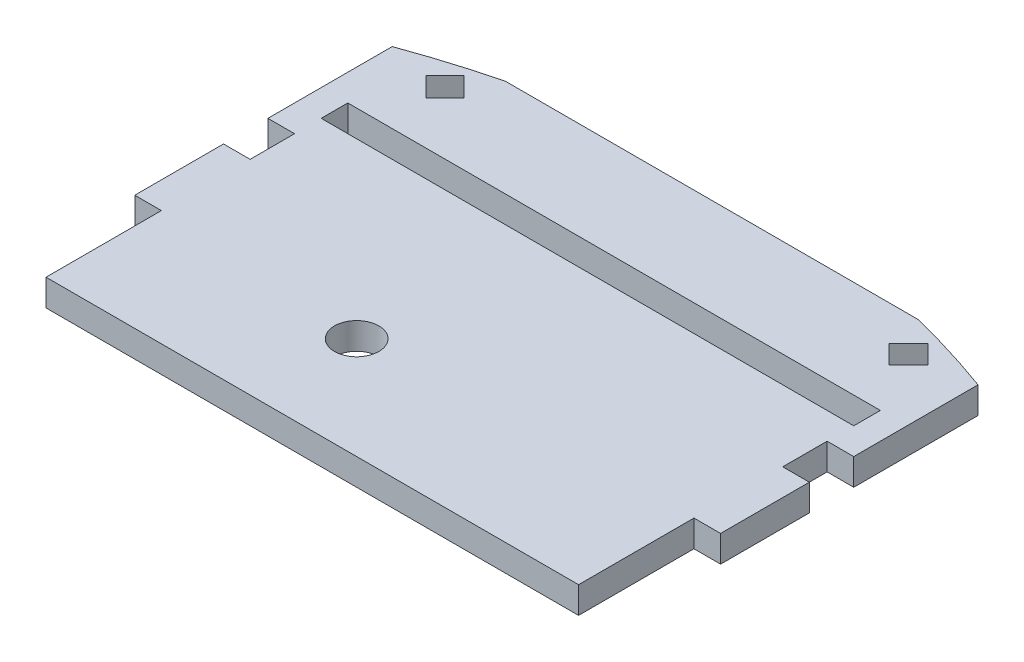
SolidWorks part; units mm, degrees
ref_plane "Front Plane" through (0, 0, 0) normal (0, 0, 1) x (1, 0, 0)
ref_plane "Top Plane" through (0, 0, 0) normal (0, 1, 0) x (1, 0, 0)
ref_plane "Right Plane" through (0, 0, 0) normal (1, 0, 0) x (0, 0, -1)
sketch "Sketch1" plane through (0, 0, 0) normal (0, 1, 0) x (1, 0, 0)
  line L1 (-30, 18) -> (30, 18)
  line L2 (-30, 18) -> (-30, -18)
  line L3 (-30, -18) -> (30, -18)
  line L4 (30, 18) -> (30, -18)
  line L5 (-30, 18) -> (30, -18) construction
  line L6 (-30, -18) -> (30, 18) construction
  point P0 (0, 0)
  dimension "D1" = 60
  dimension "D2" = 36
extrude "Boss-Extrude1" add sketch "Sketch1" along normal blind 3
sketch "Sketch2" plane through (0, 0, 0) normal (0, 1, 0) x (1, 0, 0)
  line L0 (0, 0) -> (0, -6.5) construction
  line L1 (0, -6.5) -> (-6.5, -6.5) construction
  circle A0 centre (0, -6.5) radius 2.5 construction
  circle A1 centre (-6.5, -6.5) radius 2.5
  dimension "D1" = 5
  dimension "D2" = 6.5
  dimension "D3" = 6.5
extrude "Cut-Extrude1" cut sketch "Sketch2" along normal blind 3
sketch "Sketch3" plane through (0, 0, 0) normal (0, 1, 0) x (1, 0, 0)
  line L0 (-30, 0) -> (-31.5, 0) construction
  line L1 (-30, 18) -> (-30, -18) construction
  line L2 (0, 0) -> (0, 6.3123) construction
  line L3 (33, -5) -> (30, 5) construction
  line L4 (-33, 5) -> (-30, 5)
  line L5 (-33, 5) -> (-33, -5)
  line L6 (-33, -5) -> (-30, -5)
  line L7 (-30, 5) -> (-30, -5)
  line L8 (-33, 5) -> (-30, -5) construction
  line L9 (-33, -5) -> (-30, 5) construction
  line L10 (33, 5) -> (30, -5) construction
  line L11 (30, 0) -> (31.5, 0) construction
  line L12 (30, 5) -> (30, -5)
  line L13 (33, -5) -> (30, -5)
  line L14 (33, 5) -> (33, -5)
  line L15 (33, 5) -> (30, 5)
  dimension "D1" = 3
  dimension "D2" = 10
extrude "Boss-Extrude2" add sketch "Sketch3" along normal blind 3
sketch "Sketch4" plane through (0, 0, 0) normal (0, 1, 0) x (1, 0, 0)
  line L1 (-30, 18) -> (30, 18)
  line L2 (-30, 18) -> (-30, 13)
  line L3 (-30, 13) -> (30, 13)
  line L4 (30, 18) -> (30, 13)
  dimension "D1" = 5
extrude "Cut-Extrude2" cut sketch "Sketch4" along normal blind 3
sketch "Sketch5" plane through (0, 0, 0) normal (0, 1, 0) x (1, 0, 0)
  line L0 (0, 0) -> (0, 18.5) construction
  line L2 (-30, 13) -> (30, 13) construction
  line L3 (-33, 27) -> (33, 27)
  line L4 (-33, 27) -> (-33, 10)
  line L5 (-33, 10) -> (33, 10)
  line L6 (33, 27) -> (33, 10)
  line L7 (-33, 27) -> (33, 10) construction
  line L8 (-33, 10) -> (33, 27) construction
  dimension "D1" = 66
  dimension "D2" = 17
  dimension "D3" = 3
extrude "Boss-Extrude3" add sketch "Sketch5" along normal blind 3
sketch "Sketch6" plane through (0, 0, 0) normal (0, 1, 0) x (1, 0, 0)
  line L0 (0, 0) -> (0, 14.5) construction
  line L1 (-30, 10) -> (-30, 5) construction
  line L2 (-30, 16) -> (30, 16)
  line L3 (-30, 16) -> (-30, 13)
  line L4 (-30, 13) -> (30, 13)
  line L5 (30, 16) -> (30, 13)
  line L6 (-30, 16) -> (30, 13) construction
  line L7 (-30, 13) -> (30, 16) construction
  line L8 (-33, 10) -> (-30, 10) construction
  line L9 (-30, 16) -> (-30, 17) construction
  line L10 (-30, 17) -> (-20, 27) construction
  line L11 (33, 27) -> (-33, 27) construction
  line L12 (-26.0811, 20.9189) -> (-23.9598, 23.0402)
  line L13 (-26.0811, 20.9189) -> (-28.2731, 23.1109)
  line L14 (-23.9598, 23.0402) -> (-26.1518, 25.2322)
  line L15 (-28.2731, 23.1109) -> (-26.1518, 25.2322)
  line L16 (30, 16) -> (30, 17) construction
  line L17 (30, 17) -> (20, 27) construction
  line L18 (28.2731, 23.1109) -> (26.1518, 25.2322)
  line L19 (23.9598, 23.0402) -> (26.1518, 25.2322)
  line L20 (26.0811, 20.9189) -> (28.2731, 23.1109)
  line L21 (26.0811, 20.9189) -> (23.9598, 23.0402)
  dimension "D1" = 3
  dimension "D2" = 3
  dimension "D3" = 1
  dimension "D4" = 45
  dimension "D5" = 3
  dimension "D6" = 3.1
  dimension "D7" = 5.6
extrude "Cut-Extrude3" cut sketch "Sketch6" along normal blind 3
sketch "Sketch7" plane through (0, 0, 0) normal (0, 1, 0) x (1, 0, 0)
  line L0 (-33, 27) -> (-33, 22)
  line L1 (-33, 27) -> (-33, 10) construction
  line L2 (-33, 22) -> (-28, 27)
  line L3 (33, 27) -> (-33, 27) construction
  line L4 (-33, 27) -> (-28, 27)
  line L5 (0, 0) -> (0, 4.8292) construction
  line L6 (33, 27) -> (28, 27)
  line L7 (33, 22) -> (28, 27)
  line L8 (33, 27) -> (33, 22)
  dimension "D1" = 5
extrude "Cut-Extrude4" [suppressed] cut sketch "Sketch7" along normal blind 3
sketch "Sketch8" plane through (0, 0, 0) normal (0, 1, 0) x (1, 0, 0)
  line L0 (-33, 24) -> (33, 24) construction
  line L3 (-33, 27) -> (-33, 10) construction
  line L4 (33, 10) -> (33, 27) construction
  line L5 (33, 27) -> (-33, 27) construction
  line L6 (0, 24) -> (0, -66) construction
  line L7 (-33, 24) -> (-33, 47.1897)
  line L8 (-33, 47.1897) -> (33, 47.1897)
  line L9 (33, 47.1897) -> (33, 24)
  arc A0 (-33, 24) -> (33, 24) centre (0, -66) cw
  dimension "D1" = 3
  dimension "D2" = 90
extrude "Cut-Extrude5" cut sketch "Sketch8" along normal blind 3 contours L7 A0 L9 L8
